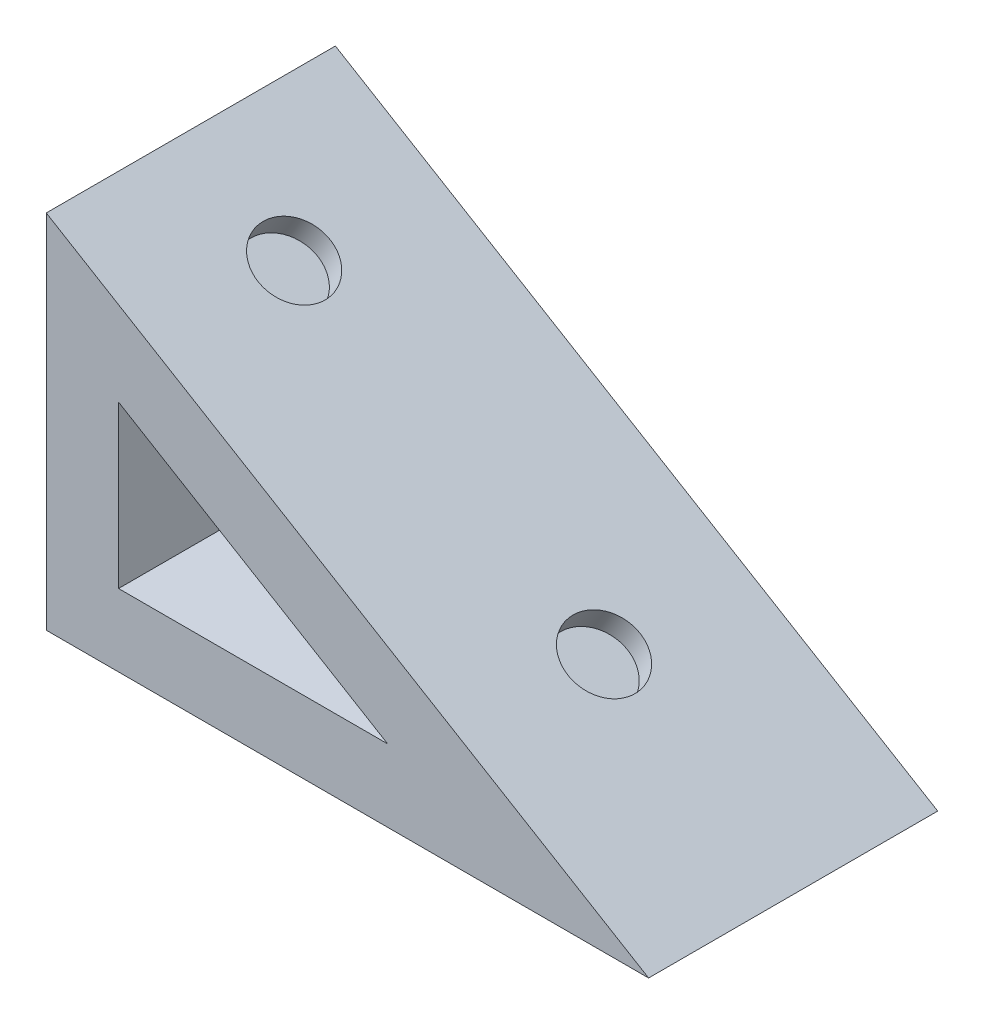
SolidWorks part; units mm, degrees
ref_plane "Front Plane" through (0, 0, 0) normal (0, 0, 1) x (1, 0, 0)
ref_plane "Top Plane" through (0, 0, 0) normal (0, 1, 0) x (1, 0, 0)
ref_plane "Right Plane" through (0, 0, 0) normal (1, 0, 0) x (0, 0, -1)
sketch "Sketch1" plane through (0, 0, 0) normal (0, 0, 1) x (1, 0, 0)
  line L0 (0, 0) -> (25, 0)
  line L1 (25, 0) -> (0, 15)
  line L2 (0, 15) -> (0, 0)
  dimension "D1" = 25
  dimension "D2" = 15
extrude "Boss-Extrude1" add sketch "Sketch1" along normal blind 12
sketch "Sketch2" plane through (0, 0, 0) normal (0, -1, 0) x (1, 0, 0)
  line L0 (0, 12) -> (25, 12) construction
  line L1 (0, 12) -> (0, 0) construction
  circle A0 centre (3, 6) radius 2
  circle A1 centre (18, 6) radius 1
  dimension "D1" = 2
  dimension "D3" = 3
  dimension "D5" = 4
  dimension "D2" = 6
  dimension "D4" = 15
extrude "Cut-Extrude1" cut sketch "Sketch2" against normal blind 2
sketch "Sketch3" plane through (6.6176, 11.0294, 0) normal (0.5145, 0.8575, 0) x (0.8575, -0.5145, 0)
  line L0 (21.4373, -12) -> (-7.7174, -12) construction
  line L1 (-7.7174, -12) -> (-7.7174, 0) construction
  line L2 (21.4373, 0) -> (-7.7174, 0) construction
  circle A0 centre (-2.7174, -6) radius 1.5
  circle A1 centre (12.2826, -6) radius 1.5
  dimension "D1" = 6
  dimension "D2" = 5
  dimension "D3" = 6
  dimension "D5" = 3
  dimension "D6" = 3
  dimension "D4" = 15
extrude "Cut-Extrude2" cut sketch "Sketch3" against normal blind 1 contours A1 | A0
sketch "Sketch4" plane through (0, 0, 12) normal (0, 0, 1) x (1, 0, 0)
  line L6 (3, 9.7014) -> (3, 3)
  line L7 (3, 3) -> (14.169, 3)
  line L8 (14.169, 3) -> (3, 9.7014)
  line L9 (3, 9.7014) -> (3, 3)
  line L10 (3, 3) -> (14.169, 3)
  line L11 (14.169, 3) -> (3, 9.7014)
  dimension "D1" = 3
extrude "Cut-Extrude3" cut sketch "Sketch4" against normal blind 10
